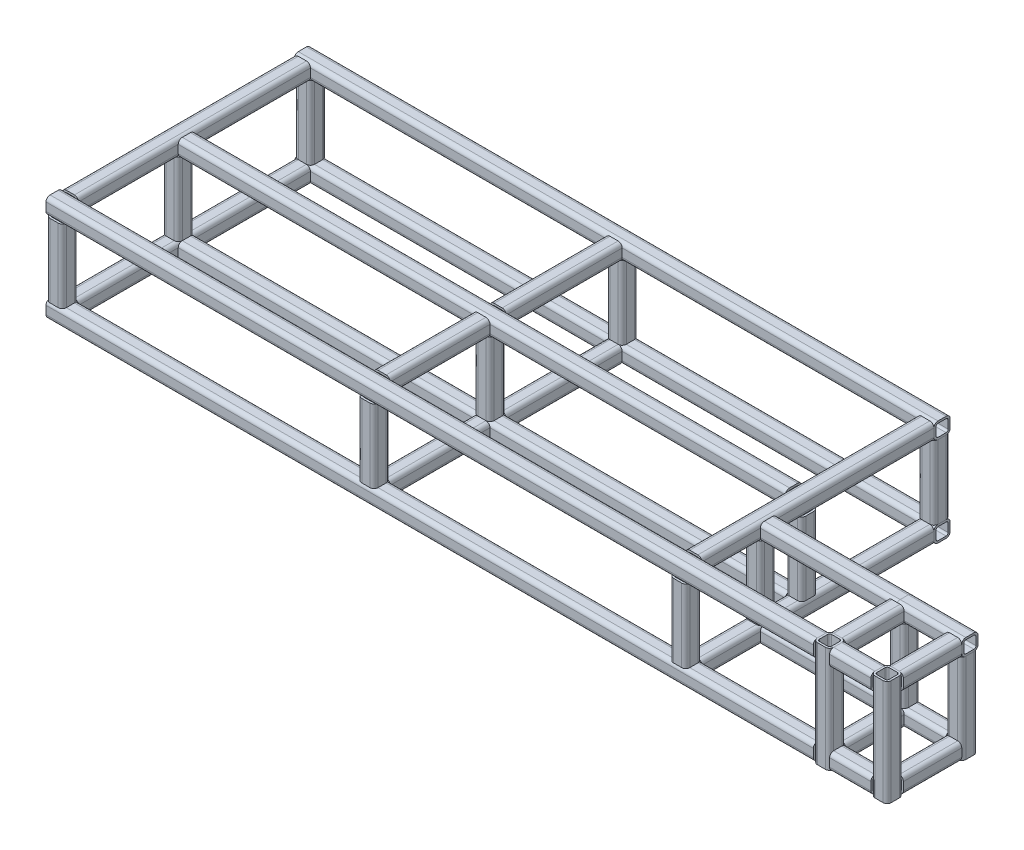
SolidWorks part; units mm, degrees
ref_plane "Front Plane" through (0, 0, 0) normal (0, 0, 1) x (1, 0, 0)
ref_plane "Top Plane" through (0, 0, 0) normal (0, 1, 0) x (1, 0, 0)
ref_plane "Right Plane" through (0, 0, 0) normal (1, 0, 0) x (0, 0, -1)
sketch3d "3DSketch1"
  line L0 (-2172.8925, 92.9083, 42.0071) -> (-2172.8925, 92.9083, 326.1753) construction
  line L1 (-2172.8925, 92.9083, 42.0071) -> (-2262.8925, 92.9083, 42.0071) construction
  line L2 (-2082.8925, 232.9083, 42.0071) -> (-2082.8925, 232.9083, 326.1753)
  line L3 (-2262.8925, -47.0917, 42.0071) -> (-2262.8925, 232.9083, 42.0071)
  line L4 (-2262.8925, 232.9083, 42.0071) -> (-2082.8925, 232.9083, 42.0071)
  line L5 (-2082.8925, 232.9083, 42.0071) -> (-2082.8925, -47.0917, 42.0071)
  line L6 (-2082.8925, -47.0917, 42.0071) -> (-2262.8925, -47.0917, 42.0071)
  line L7 (-2082.8925, -47.0917, 42.0071) -> (-2082.8925, -47.0917, 326.1753)
  line L8 (-2262.8925, -47.0917, 326.1753) -> (-2082.8925, -47.0917, 326.1753)
  line L9 (-2262.8925, -47.0917, 326.1753) -> (-2262.8925, 232.9083, 326.1753)
  line L10 (-2262.8925, 232.9083, 326.1753) -> (-2082.8925, 232.9083, 326.1753)
  line L11 (-2082.8925, -47.0917, 326.1753) -> (-2082.8925, 232.9083, 326.1753)
  line L12 (-2262.8925, -47.0917, 326.1753) -> (-2082.8925, 232.9083, 326.1753) construction
  line L13 (-2262.8925, 232.9083, 326.1753) -> (-2082.8925, -47.0917, 326.1753) construction
  line L14 (-2262.8925, 232.9083, 42.0071) -> (-2262.8925, 232.9083, 326.1753)
  line L15 (-2262.8925, -47.0917, 42.0071) -> (-2262.8925, -47.0917, 326.1753)
  line L16 (-2262.8925, 232.9083, 326.1753) -> (-4662.8925, 232.9083, 326.1753)
  line L17 (-4662.8925, 232.9083, 326.1753) -> (-4662.8925, -47.0917, 326.1753)
  line L18 (-2262.8925, -47.0917, 326.1753) -> (-4662.8925, -47.0917, 326.1753)
  line L19 (-4662.8925, 232.9083, -500.9929) -> (-4662.8925, 232.9083, 326.1753)
  line L21 (-4662.8925, 232.9083, -500.9929) -> (-4662.8925, -47.0917, -500.9929)
  line L22 (-4662.8925, -47.0917, -500.9929) -> (-4662.8925, -47.0917, 326.1753)
  line L23 (-4662.8925, 232.9083, -500.9929) -> (-2712.8925, 232.9083, -500.9929)
  line L24 (-2712.8925, 232.9083, -500.9929) -> (-2712.8925, 232.9083, 326.1753)
  line L25 (-2712.8925, 232.9083, 326.1753) -> (-2712.8925, -47.0917, 326.1753)
  line L26 (-2712.8925, -47.0917, 326.1753) -> (-2712.8925, -47.0917, -500.9929)
  line L27 (-2712.8925, -47.0917, -500.9929) -> (-2712.8925, 232.9083, -500.9929)
  line L28 (-2712.8925, -47.0917, -500.9929) -> (-4662.8925, -47.0917, -500.9929)
  line L29 (-3687.8925, 232.9083, -500.9929) -> (-3687.8925, 232.9083, 326.1753)
  line L30 (-3687.8925, 232.9083, 326.1753) -> (-3687.8925, -47.0917, 326.1753)
  line L31 (-3687.8925, -47.0917, 326.1753) -> (-3687.8925, -47.0917, -500.9929)
  line L32 (-3687.8925, -47.0917, -500.9929) -> (-3687.8925, 232.9083, -500.9929)
  line L33 (-2712.8925, 232.9083, -87.4088) -> (-4662.8925, 232.9083, -87.4088)
  line L34 (-4662.8925, 232.9083, -87.4088) -> (-4662.8925, -47.0917, -87.4088)
  line L35 (-4662.8925, -47.0917, -87.4088) -> (-2712.8925, -47.0917, -87.4088)
  line L36 (-2712.8925, -47.0917, -87.4088) -> (-2712.8925, 232.9083, -87.4088)
  line L37 (-3687.8925, 232.9083, -87.4088) -> (-3687.8925, -47.0917, -87.4088)
  line L38 (-2262.8925, 232.9083, 42.0071) -> (-2712.8925, 232.9083, 42.0071)
  line L39 (-2712.8925, 232.9083, 42.0071) -> (-2712.8925, -47.0917, 42.0071)
  line L40 (-2712.8925, -47.0917, 42.0071) -> (-2262.8925, -47.0917, 42.0071)
  arc A0 (-2218.6244, 181.8385, 42.0071) -> (-2249.4167, 157.2825, 42.0071) centre (-2172.8925, 92.9083, 42.0071) ccw construction
  point P14 (-2172.8925, 92.9083, 142.0071)
  point P34 (-3687.8925, 232.9083, -87.4088)
  dimension "D1" = 284.1682
  dimension "D2" = 1950
  dimension "D5" = 450
  dimension "D3" = 90
  dimension "D4" = 180
  dimension "D6" = 284.1682
  dimension "D7" = 827.1682
  dimension "D8" = 280
other "Structural Member1"
ref_plane "Plane1"
sketch "Sketch1" plane through (-2262.8925, 232.9083, 67.4071) normal (1, 0, 0) x (0, -1, 0)
  line L0 (-12.7, -19.05) -> (12.7, -19.05)
  line L1 (-19.05, -12.7) -> (-19.05, 12.7)
  line L2 (12.7, 19.05) -> (-12.7, 19.05)
  line L3 (19.05, 12.7) -> (19.05, -12.7)
  line L4 (-12.7, -25.4) -> (12.7, -25.4)
  line L5 (-25.4, -12.7) -> (-25.4, 12.7)
  line L6 (12.7, 25.4) -> (-12.7, 25.4)
  line L7 (25.4, 12.7) -> (25.4, -12.7)
  line L8 (0, 0) -> (19.05, 0) construction
  line L9 (0, 0) -> (0, 19.05) construction
  arc A0 (25.4, 12.7) -> (12.7, 25.4) centre (12.7, 12.7) ccw
  arc A1 (12.7, -25.4) -> (25.4, -12.7) centre (12.7, -12.7) ccw
  arc A2 (-25.4, -12.7) -> (-12.7, -25.4) centre (-12.7, -12.7) ccw
  arc A3 (-12.7, 25.4) -> (-25.4, 12.7) centre (-12.7, 12.7) ccw
  arc A4 (-12.7, 19.05) -> (-19.05, 12.7) centre (-12.7, 12.7) ccw
  arc A5 (19.05, 12.7) -> (12.7, 19.05) centre (12.7, 12.7) ccw
  arc A6 (12.7, -19.05) -> (19.05, -12.7) centre (12.7, -12.7) ccw
  arc A7 (-19.05, -12.7) -> (-12.7, -19.05) centre (-12.7, -12.7) ccw
  point P3 (0, 25.4)
  point P4 (25.4, 0)
  point P5 (0, -25.4)
  point P6 (-25.4, 0)
  point P7 (-25.4, 25.4)
  point P8 (-25.4, -25.4)
  point P33 (0, 0)
  point P35 (25.4, -25.4)
  point P36 (25.4, 25.4)
  point P37 (0, 0)
  dimension "D1" = 12.7
  dimension "Thickness" = 6.35
  dimension "V_leg" = 50.8
other "Trim/Extend1"
other "Trim/Extend2"
